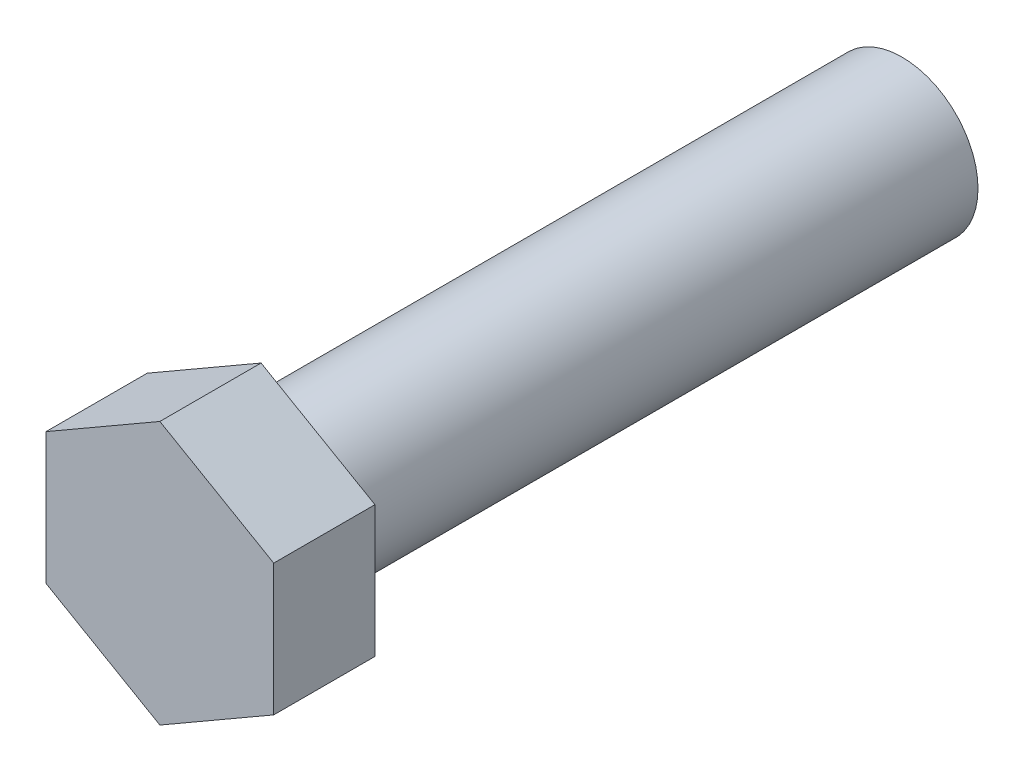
SolidWorks part; units mm, degrees
ref_plane "Front Plane" through (0, 0, 0) normal (1, 0, 0) x (0, 1, 0)
ref_plane "Top Plane" through (0, 0, 0) normal (0, 0, 1) x (0, 1, 0)
ref_plane "Right Plane" through (0, 0, 0) normal (0, 1, 0) x (-1, 0, 0)
sketch "Sketch1"
sketch_block_instance "W14x730-1-1"
sketch_block "W14x730-1" parameters "D4"=15.24, "D1"=454.406, "D2"=569.468, "D3"=77.978, "D5"=124.714, "D6"=533.4, "D7"=27.3509, "D8"=8374.3758, "D9"=3499.6788, "D10"=18059.4
sketch "sk body" plane through (0, 0, 0) normal (0, 0, 1) x (0, 1, 0)
  circle A0 centre (0, 0) radius 28.575
  dimension "D1" = 57.15
sketch "sk Max dia" plane through (0, 0, 0) normal (0, 0, 1) x (0, 1, 0)
  circle A0 centre (0, 0) radius 52.2097
  dimension "D1" = 104.4194
sketch "Sketch3" plane through (0, 0, 0) normal (0, 0, 1) x (0, 1, 0)
  line L1 (49.4934, 0) -> (24.7467, 42.8625)
  line L2 (24.7467, 42.8625) -> (-24.7467, 42.8625)
  line L3 (-24.7467, 42.8625) -> (-49.4934, 0)
  line L4 (-49.4934, 0) -> (-24.7467, -42.8625)
  line L5 (-24.7467, -42.8625) -> (24.7467, -42.8625)
  line L6 (24.7467, -42.8625) -> (49.4934, 0)
  circle A0 centre (0, 0) radius 42.8625 construction
  dimension "D1" = 85.725
extrude "bolt Head" add sketch "Sketch3" along normal blind 38.1
extrude "bolt Body" add sketch "sk body" against normal blind 241.3
